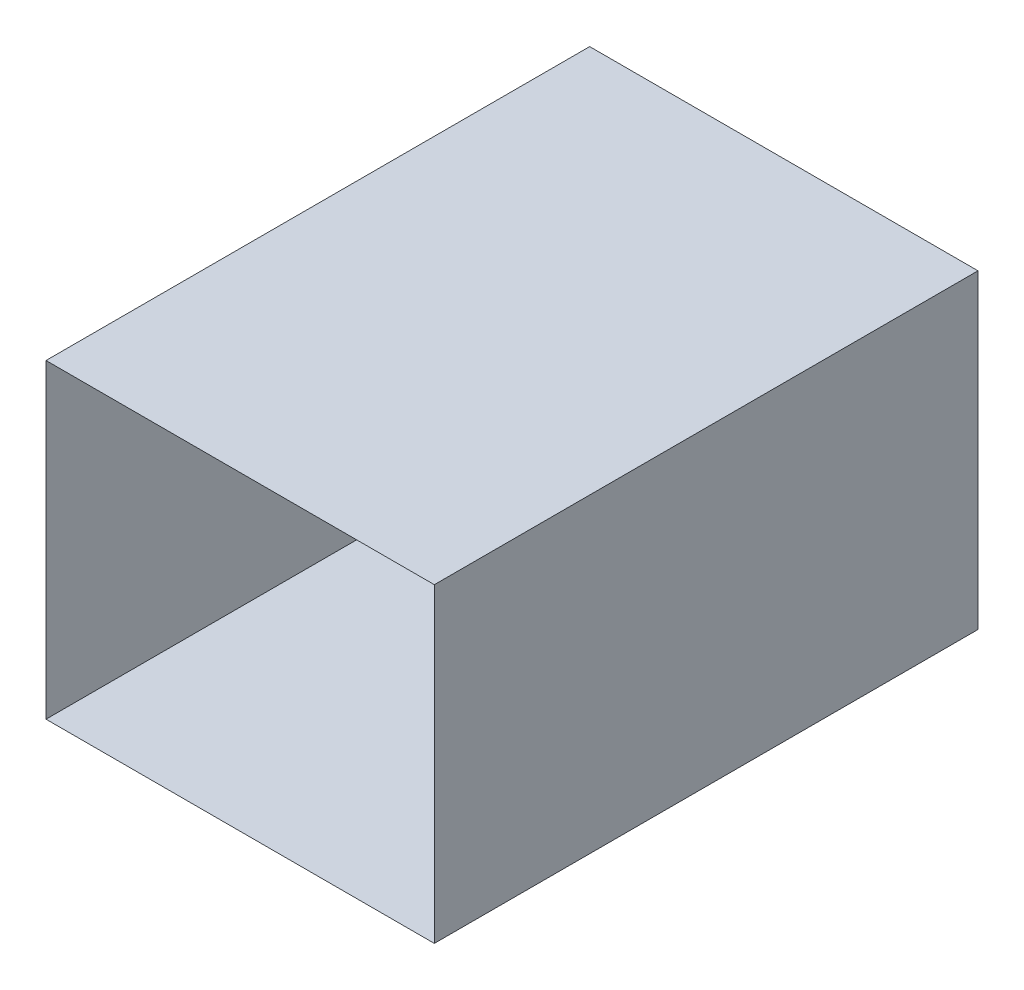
SolidWorks part; units mm, degrees
other "Kamera1"
ref_plane "Vorne" through (0, 0, 0) normal (0, 0, 1) x (1, 0, 0)
ref_plane "Oben" through (0, 0, 0) normal (0, 1, 0) x (1, 0, 0)
ref_plane "Seite" through (0, 0, 0) normal (1, 0, 0) x (0, 0, -1)
sketch "Skizze1" plane through (0, 0, 0) normal (0, 0, 1) x (1, 0, 0)
  line L0 (-125, 0) -> (125, 0)
  line L1 (125, 0) -> (125, 200)
  line L2 (125, 200) -> (-125, 200)
  line L3 (-125, 0) -> (-125, 200)
  point P3 (0, 0)
  dimension "Breite" = 250
  dimension "Höhe" = 200
surface "Oberfläche-Linear austragen1" sketch "Skizze1" parameters "Tiefe"=350
surface "Oberfläche-Ebene1"
surface "Oberfläche-Ebene2"
